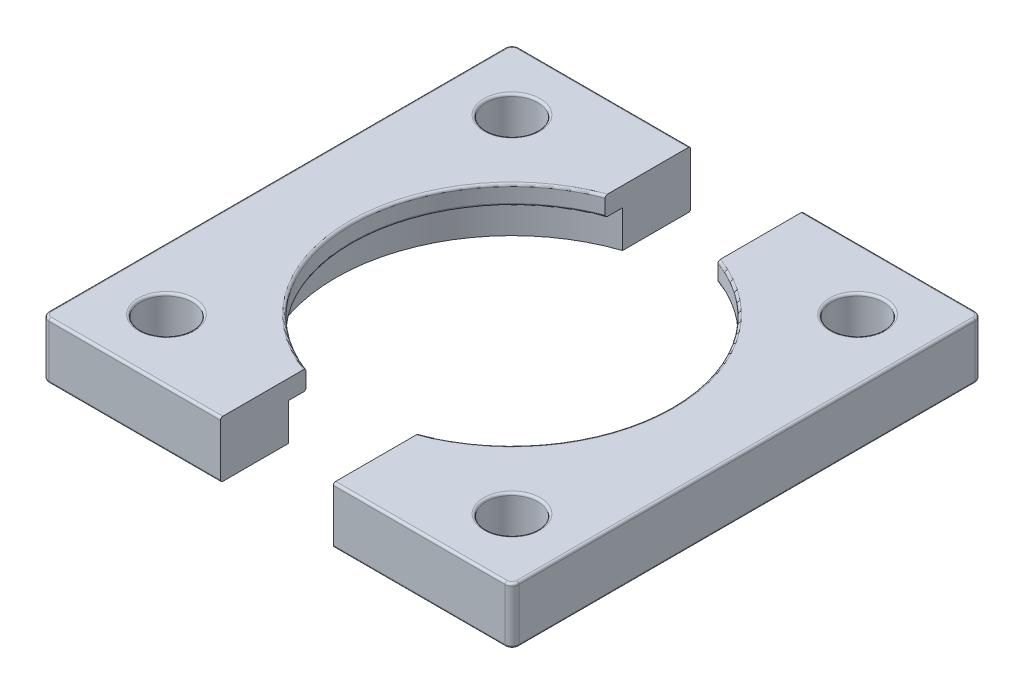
SolidWorks part; units mm, degrees
ref_plane "Front Plane" through (0, 0, 0) normal (0, 0, 1) x (1, 0, 0)
ref_plane "Top Plane" through (0, 0, 0) normal (0, 1, 0) x (1, 0, 0)
ref_plane "Right Plane" through (0, 0, 0) normal (1, 0, 0) x (0, 0, -1)
sketch "Sketch1" plane through (0, 0, 0) normal (0, 1, 0) x (1, 0, 0)
  line L0 (-34, 0) -> (34, 0) construction
  line L1 (0, 34) -> (0, -34) construction
  line L2 (12, 50) -> (12, 31.8119)
  line L3 (-48.5, 50) -> (-12, 50)
  line L4 (-50, 48.5) -> (-50, -48.5)
  line L5 (-48.5, -50) -> (-12, -50)
  line L6 (50, 48.5) -> (50, -48.5)
  line L7 (-12, 50) -> (-12, 31.8119)
  line L8 (12, 50) -> (48.5, 50)
  line L9 (12, -31.8119) -> (12, -50)
  line L10 (-12, -31.8119) -> (-12, -50)
  line L11 (12, -50) -> (48.5, -50)
  arc A0 (-12, 31.8119) -> (-12, -31.8119) centre (0, 0) ccw
  circle A1 centre (-36.75, 36.75) radius 5.5
  circle A2 centre (36.75, 36.75) radius 5.5
  circle A3 centre (36.75, -36.75) radius 5.5
  circle A4 centre (-36.75, -36.75) radius 5.5
  arc A5 (-50, -48.5) -> (-48.5, -50) centre (-48.5, -48.5) ccw
  arc A6 (48.5, -50) -> (50, -48.5) centre (48.5, -48.5) ccw
  arc A7 (48.5, 50) -> (50, 48.5) centre (48.5, 48.5) cw
  arc A8 (-48.5, 50) -> (-50, 48.5) centre (-48.5, 48.5) ccw
  arc A9 (12, -31.8119) -> (12, 31.8119) centre (0, 0) ccw
  point P21 (-50, -50)
  point P26 (50, 50)
  point P29 (-50, 50)
  dimension "D1" = 68
  dimension "D6" = 11
  dimension "D9" = 1.5
  dimension "D10" = 24
  dimension "D2" = 100
  dimension "D3" = 100
  dimension "D4" = 50
  dimension "D5" = 50
  dimension "D7" = 73.5
  dimension "D8" = 73.5
  dimension "D11" = 12
extrude "Boss-Extrude1" add sketch "Sketch1" along normal blind 12
sketch "Sketch2" plane through (0, 0, 0) normal (0, -1, 0) x (1, 0, 0)
  circle A0 centre (0, 0) radius 37.5
  dimension "D1" = 75
extrude "Cut-Extrude1" cut sketch "Sketch2" against normal blind 7.9
fillet "Fillet1" radius 0.5 14 edges at (-30.25, 0, -50) (-49.5607, 0, -49.5607) (-30.25, 0, 50) (-49.5607, 0, 49.5607) (-30.25, 12, -50) (-49.5607, 12, -49.5607) (-30.25, 12, 50) (-49.5607, 12, 49.5607) (-34, 12, 0) (-34, 7.9, 0) (-50, 0, 0) (-50, 12, 0) (-36.75, 12, -31.25) (-36.75, 12, 31.25)
fillet "Fillet2" radius 0.5 14 edges at (30.25, 0, 50) (49.5607, 0, 49.5607) (50, 0, 0) (49.5607, 0, -49.5607) (30.25, 12, 50) (49.5607, 12, 49.5607) (50, 12, 0) (49.5607, 12, -49.5607) (34, 7.9, 0) (34, 12, 0) (30.25, 0, -50) (30.25, 12, -50) (36.75, 12, -42.25) (36.75, 12, 42.25)
